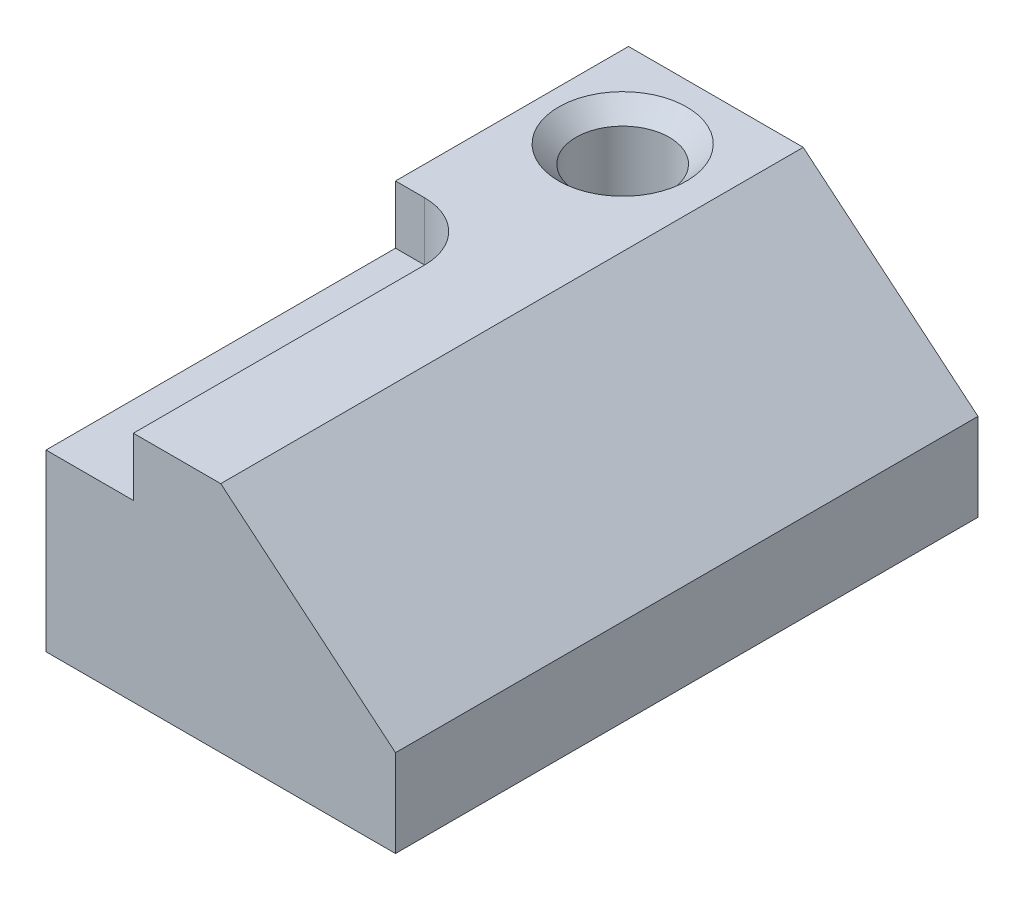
SolidWorks part; units mm, degrees
ref_plane "Front Plane" through (0, 0, 0) normal (0, 0, 1) x (1, 0, 0)
ref_plane "Top Plane" through (0, 0, 0) normal (0, 1, 0) x (1, 0, 0)
ref_plane "Right Plane" through (0, 0, 0) normal (1, 0, 0) x (0, 0, -1)
sketch "Sketch5" plane through (0, 0, 0) normal (0, 0, 1) x (1, 0, 0)
  line L0 (0, 0) -> (0, 50.8)
  line L1 (0, 50.8) -> (38.1, 50.8)
  line L2 (38.1, 50.8) -> (76.2, 19.05)
  line L3 (76.2, 19.05) -> (76.2, 0)
  line L4 (76.2, 0) -> (0, 0)
  dimension "D1" = 50.8
  dimension "D2" = 38.1
  dimension "D3" = 19.05
  dimension "D4" = 76.2
extrude "Extrude2" add sketch "Sketch5" along normal blind 127
sketch "Sketch6" plane through (0, 50.8, 0) normal (0, 1, 0) x (-1, 0, 0)
  line L0 (0, 127) -> (0, 0) construction
  line L1 (-38.1, 0) -> (0, 0) construction
  circle A0 centre (-17.78, 19.05) radius 10.16
  point P4 (-19.05, 0)
  dimension "D1" = 20.32
  dimension "D2" = 17.78
  dimension "D3" = 19.05
extrude "Cut-Extrude3" cut sketch "Sketch6" against normal through all
chamfer "Chamfer2" distance 3.81 angle 45 1 edges at (17.78, 50.8, 29.21)
sketch "Sketch7" plane through (0, 50.8, 0) normal (0, 1, 0) x (-1, 0, 0)
  line L1 (0, 127) -> (-19.05, 127)
  line L2 (0, 127) -> (0, 50.8)
  line L3 (0, 50.8) -> (-19.05, 50.8)
  line L4 (-19.05, 127) -> (-19.05, 50.8)
  dimension "D1" = 76.2
  dimension "D2" = 19.05
extrude "Cut-Extrude4" cut sketch "Sketch7" against normal blind 12.7
fillet "Fillet2" radius 12.7 1 edges at (19.05, 44.45, 50.8)
